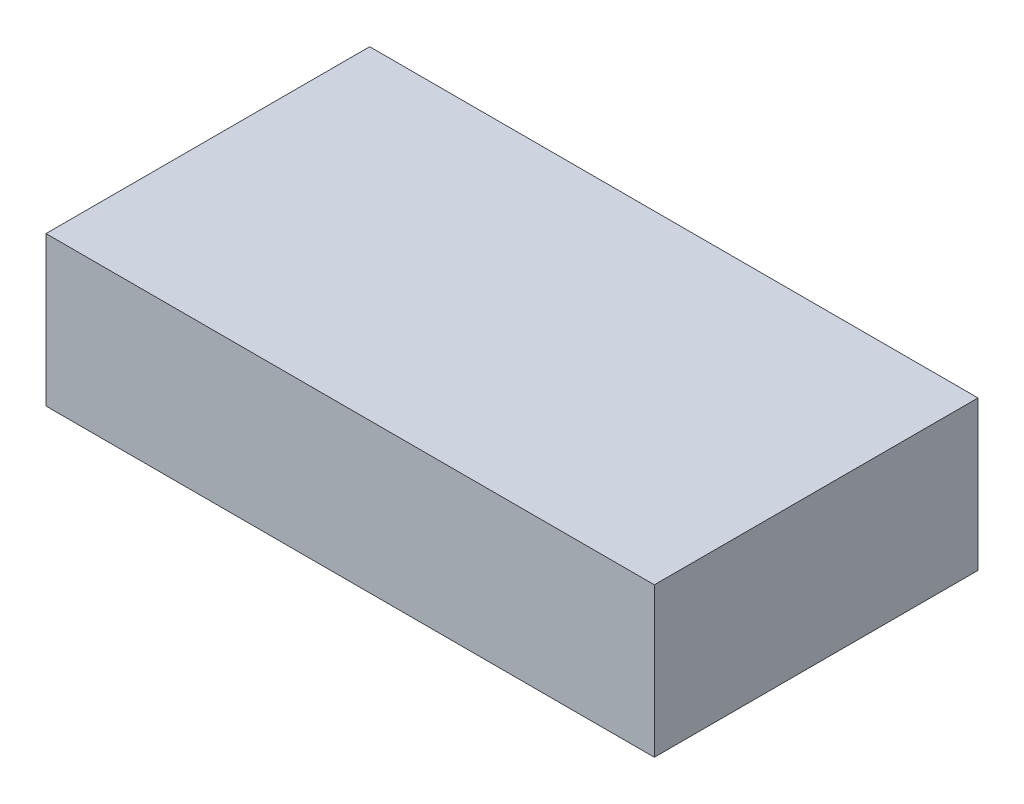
SolidWorks part; units mm, degrees
ref_plane "Спереди" through (0, 0, 0) normal (0, 0, 1) x (1, 0, 0)
ref_plane "Сверху" through (0, 0, 0) normal (0, 1, 0) x (1, 0, 0)
ref_plane "Справа" through (0, 0, 0) normal (1, 0, 0) x (0, 0, -1)
sketch "Sketch2" plane through (0, 0, 0) normal (0, 0, 1) x (1, 0, 0)
  line L1 (-73.3, 0) -> (73.3, 0)
  line L2 (-73.3, 0) -> (-73.3, 36)
  line L3 (-73.3, 36) -> (73.3, 36)
  line L4 (73.3, 0) -> (73.3, 36)
  dimension "D1" = 36
  dimension "D2" = 146.6
extrude "Extrude1" add sketch "Sketch2" against normal blind 78
